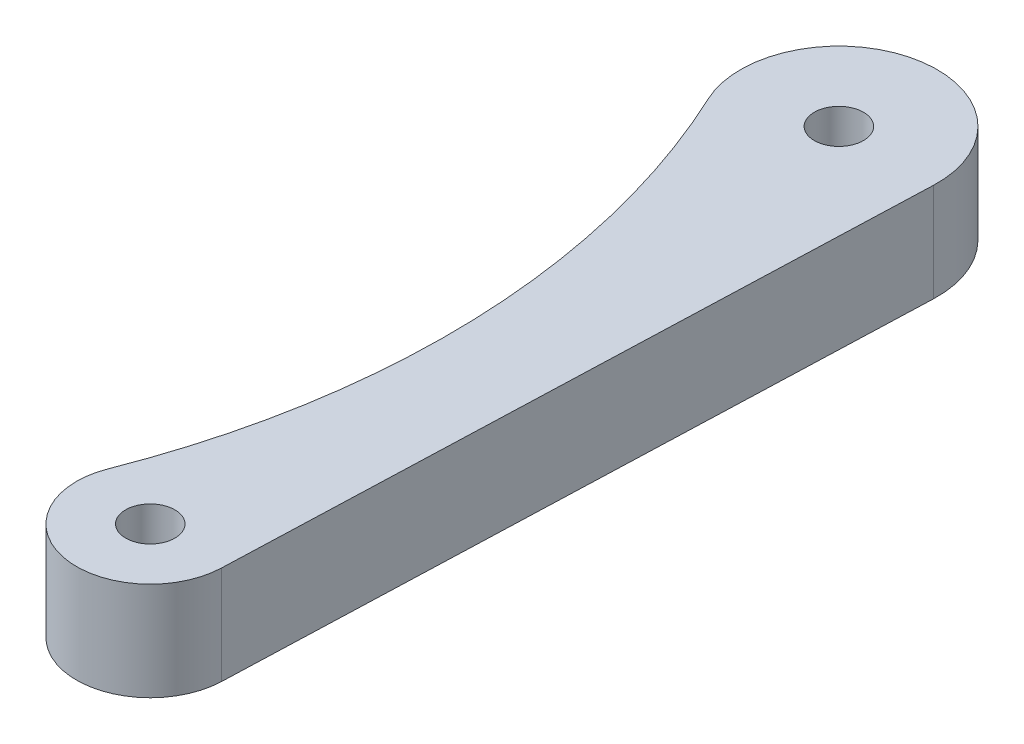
SolidWorks part; units mm, degrees
ref_plane "Front Plane" through (0, 0, 0) normal (0, 0, 1) x (1, 0, 0)
ref_plane "Top Plane" through (0, 0, 0) normal (0, 1, 0) x (1, 0, 0)
ref_plane "Right Plane" through (0, 0, 0) normal (1, 0, 0) x (0, 0, -1)
sketch "Sketch1" plane through (0, 0, 0) normal (0, 1, 0) x (1, 0, 0)
  line L0 (0, 0) -> (0, 70) construction
  line L1 (9.9936, 69.6429) -> (7.4952, -0.2679)
  arc A0 (-7.5, 0) -> (7.4952, -0.2679) centre (0, 0) ccw
  arc A1 (10, 70) -> (-10, 70) centre (0, 70) ccw
  circle A2 centre (0, 70) radius 2.5
  circle A3 centre (0, 0) radius 2.5
  circle A4 centre (0, 70) radius 10 construction
  arc A5 (0, 7.5) -> (7.4952, -0.2679) centre (0, 0) ccw construction
  arc A6 (-9.0561, 65.7589) -> (-6.9861, 2.7283) centre (-81.5051, 31.8304) cw
  arc A7 (-7.5, 0) -> (-6.9861, 2.7283) centre (0, 0) cw
  arc A8 (-10, 70) -> (-9.0561, 65.7589) centre (0, 70) ccw
  arc A9 (9.9936, 69.6429) -> (10, 70) centre (0, 70) ccw
  dimension "D1" = 10
  dimension "D3" = 5
  dimension "D4" = 80
  dimension "D5" = 7.5
  dimension "D2" = 70
extrude "Boss-Extrude1" add sketch "Sketch1" along normal blind 10 contours A0 A1
